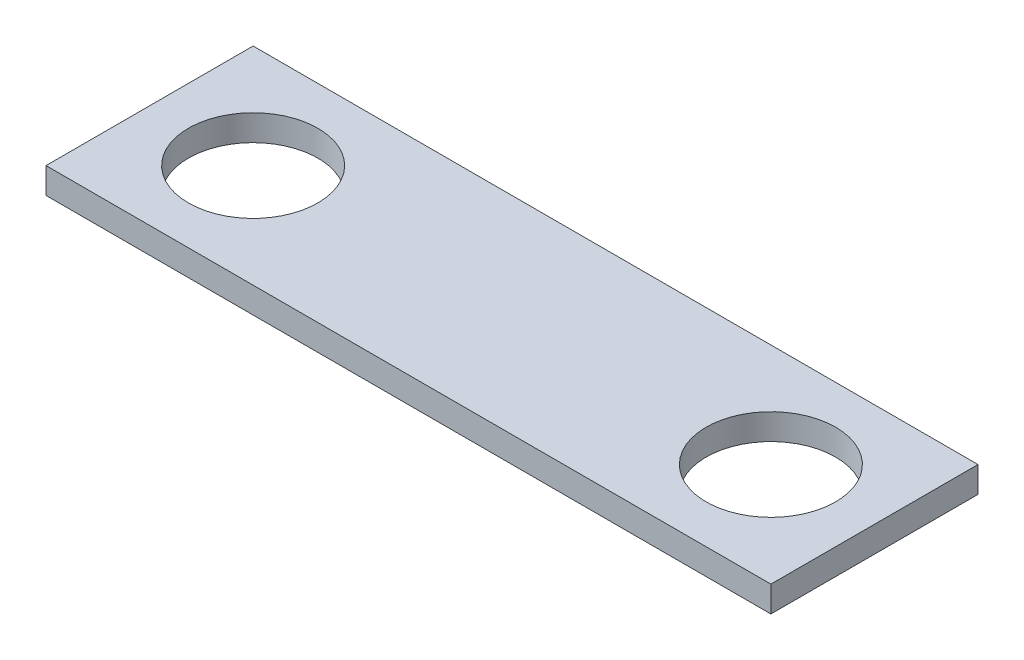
SolidWorks part; units mm, degrees
ref_plane "Спереди" through (0, 0, 0) normal (0, 0, 1) x (1, 0, 0)
ref_plane "Сверху" through (0, 0, 0) normal (0, 1, 0) x (1, 0, 0)
ref_plane "Справа" through (0, 0, 0) normal (1, 0, 0) x (0, 0, -1)
sketch "Эскиз1" plane through (0, 0, 0) normal (0, 1, 0) x (1, 0, 0)
  line L1 (0, 0) -> (14, 0)
  line L2 (0, 0) -> (0, 4)
  line L3 (0, 4) -> (14, 4)
  line L4 (14, 0) -> (14, 4)
  dimension "D1" = 4
  dimension "D2" = 14
extrude "Бобышка-Вытянуть1" add sketch "Эскиз1" along normal blind 0.5
sketch "Эскиз2" plane through (0, 0.5, 0) normal (0, 1, 0) x (1, 0, 0)
  line L0 (7, 4) -> (7, -0.7579) construction
  line L1 (14, 4) -> (0, 4) construction
  line L2 (0, 2) -> (14, 2) construction
  line L3 (0, 4) -> (0, 0) construction
  line L4 (14, 0) -> (14, 4) construction
  circle A0 centre (2, 2) radius 1.25
  circle A1 centre (12, 2) radius 1.25
  dimension "D1" = 2.5
  dimension "D2" = 10
extrude "Вырез-Вытянуть1" cut sketch "Эскиз2" against normal through all
